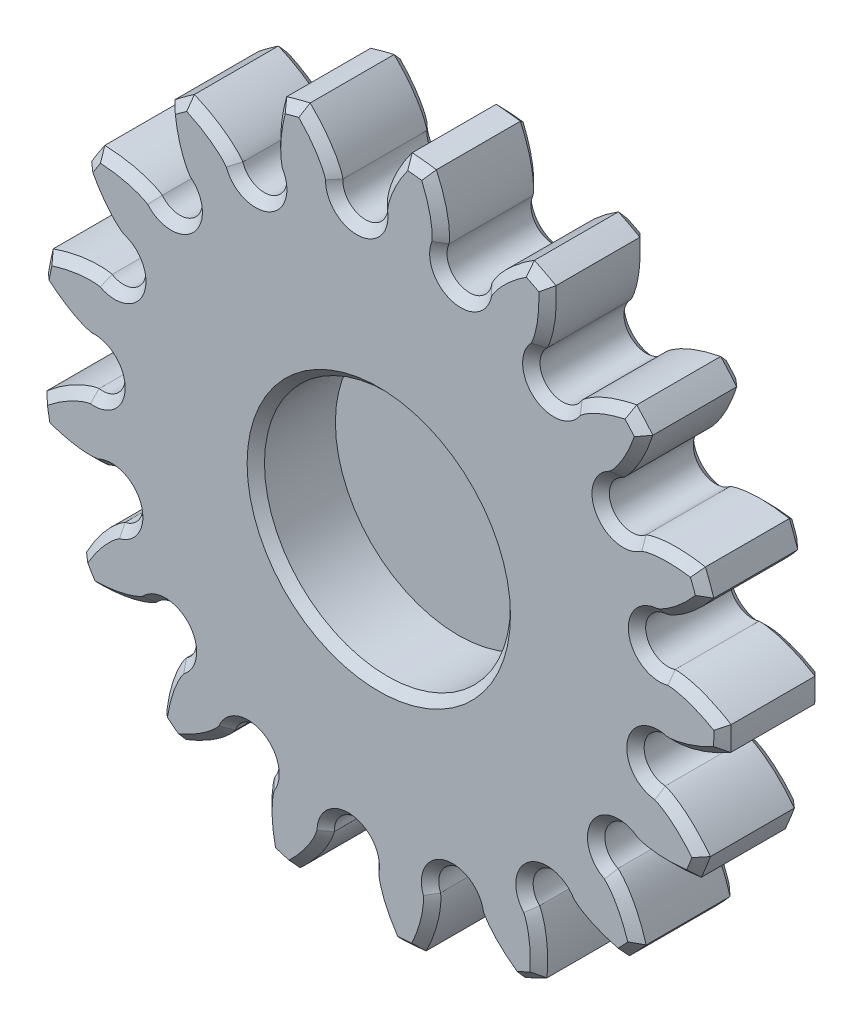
SolidWorks part; units mm, degrees
ref_plane "Plan de face" through (0, 0, 0) normal (0, 0, 1) x (1, 0, 0)
ref_plane "Plan de dessus" through (0, 0, 0) normal (0, 1, 0) x (1, 0, 0)
ref_plane "Plan de droite" through (0, 0, 0) normal (1, 0, 0) x (0, 0, -1)
sketch "Esquisse6" plane through (0, 0, 0) normal (0, 0, 1) x (1, 0, 0)
  line L0 (0.3196, 21.2476) -> (0, 0) construction
  line L1 (0, 0) -> (-1.4007, 18.0708) construction
  line L2 (0, 0) -> (5.2218, 17.3565) construction
  line L3 (2.5468, 23.613) -> (0, 0) construction
  line L4 (-0.1459, -1.3527) -> (5.4607, 17.2828)
  line L5 (-0.1459, -1.3527) -> (-1.6498, 18.0498)
  line L6 (-1.4007, 18.0708) -> (-1.6498, 18.0498)
  line L7 (-1.6498, 18.0498) -> (5.2218, 17.3565) construction
  line L8 (5.2218, 17.3565) -> (5.4607, 17.2828)
  line L10 (-0.1459, -1.3527) -> (-1.6711, 18.3248) construction
  line L11 (-0.1459, -1.3527) -> (5.5402, 17.547) construction
  circle A0 centre (0, 0) radius 21.25 construction
  circle A1 centre (0, 0) radius 18.125 construction
  arc A2 (3.3803, 23.5082) -> (1.7102, 23.6883) centre (0, 0) ccw
  arc A3 (-1.4007, 18.0708) -> (0, 19.9609) centre (-1.5211, 19.6241) ccw
  arc A4 (5.2218, 17.3565) -> (4.2564, 19.5018) centre (5.6707, 18.8484) cw
  arc A5 (-1.6711, 18.3248) -> (-0.2506, 19.9348) centre (-1.5211, 19.6241) ccw construction
  arc A6 (3.551, 23.7358) -> (1.592, 23.9471) centre (0, 0) ccw construction
  arc A7 (5.5402, 17.547) -> (4.4956, 19.4229) centre (5.6707, 18.8484) cw construction
  spline S0 degree 4 poles (0, 19.9609) (0.0003, 19.9757) (0.0022, 20.017) (0.0095, 20.095) (0.0268, 20.2218) (0.0567, 20.3824) (0.1044, 20.5884) (0.1722, 20.8287) (0.2586, 21.09) (0.3653, 21.3706) (0.483, 21.6471) (0.6105, 21.9192) (0.7469, 22.1869) (0.9224, 22.5066) (1.1483, 22.8838) (1.432, 23.3138) (1.7801, 23.79) (2.1572, 24.2587) (2.553, 24.7099) (2.9687, 25.1459) (3.3977, 25.5636) (3.8471, 25.9686) (4.2439, 26.3034) (4.6058, 26.5894) (4.8908, 26.8073) (5.1584, 27.0013) (5.4159, 27.1872) (5.8578, 27.4838) (6.1363, 27.6635) (6.5758, 27.9339) (6.7396, 28.0269) (6.8696, 28.1032) knots 0 0 0 0 0 0.005377 0.015084 0.028532 0.04661 0.064855 0.092111 0.119476 0.146842 0.174209 0.201575 0.228941 0.256307 0.307035 0.361767 0.4165 0.471232 0.525964 0.580697 0.635429 0.690161 0.744894 0.77226 0.799626 0.826992 0.854358 0.909091 0.954545 1 1 1 1 1 construction
  spline S1 degree 4 poles (0, 19.9609) (0.0003, 19.9757) (0.0022, 20.017) (0.0095, 20.095) (0.0268, 20.2218) (0.0567, 20.3824) (0.1044, 20.5884) (0.1722, 20.8287) (0.2586, 21.09) (0.3653, 21.3706) (0.483, 21.6471) (0.6105, 21.9192) (0.7469, 22.1869) (0.9224, 22.5066) (1.1483, 22.8838) (1.3736, 23.2253) (1.5674, 23.497) (1.6836, 23.653) (1.7102, 23.6883) knots 0 0 0 0 0 0.005377 0.015084 0.028532 0.04661 0.064855 0.092111 0.119476 0.146842 0.174209 0.201575 0.228941 0.256307 0.307035 0.361767 0.377899 0.377899 0.377899 0.377899 0.377899
  spline S2 degree 4 poles (4.2564, 19.5018) (4.2592, 19.5163) (4.2662, 19.5571) (4.2757, 19.6349) (4.2858, 19.7624) (4.2908, 19.9257) (4.2881, 20.1371) (4.2732, 20.3864) (4.2445, 20.6601) (4.2001, 20.957) (4.144, 21.2522) (4.0775, 21.5453) (4.0013, 21.8359) (3.898, 22.1856) (3.7578, 22.6024) (3.6104, 22.9841) (3.479, 23.2908) (3.3988, 23.468) (3.3803, 23.5082) knots 0 0 0 0 0 0.005377 0.015084 0.028532 0.04661 0.064855 0.092111 0.119476 0.146842 0.174209 0.201575 0.228941 0.256307 0.307035 0.361767 0.377899 0.377899 0.377899 0.377899 0.377899
  spline S3 degree 1 poles (-0.2506, 19.9348) (1.592, 23.9471) knots 0 0 1 1 construction
  spline S4 degree 1 poles (4.4956, 19.4229) (3.551, 23.7358) knots 0 0 1 1 construction
  spline S5 degree 3 poles (-0.2506, 19.9348) (-0.2464, 20.1313) (-0.1759, 20.5289) (0.0317, 21.2409) (0.5449, 22.4428) (1.1512, 23.3609) (1.592, 23.9471) knots -0.002856 -0.002856 -0.002856 -0.002856 0.046285 0.095426 0.193707 0.39027 0.39027 0.39027 0.39027 construction
  spline S6 degree 3 poles (3.551, 23.7358) (3.8566, 23.0691) (4.2532, 22.0428) (4.4983, 20.7591) (4.5494, 20.0193) (4.5335, 19.6158) (4.4956, 19.4229) knots -0.002856 -0.002856 -0.002856 -0.002856 0.193707 0.291989 0.341129 0.39027 0.39027 0.39027 0.39027 construction
  point P14 (-1.4007, 18.0708)
  dimension "D1" = 42.5
  dimension "D2" = 2.5
  dimension "D3" = 3.125
  dimension "D4" = 5.294
  dimension "D5" = 0.25
extrude "Boss.-Extru.3" add sketch "Esquisse6" along normal blind 7
pattern_circular "Répétition circulaire1" count 17 every 21.176 of "Boss.-Extru.3"
sketch "Esquisse2" plane through (0, 0, 10) normal (0, 0, 1) x (1, 0, 0)
  circle A0 centre (0, 0) radius 0.5
  dimension "D1" = 1
sketch "Esquisse3" plane through (0, 0, 10) normal (0, 0, 1) x (1, 0, 0)
  line L0 (1.3829, 74.9872) -> (0, 0) construction
  line L1 (0, 0) -> (4.032, 90.3021) construction
  line L2 (0, 0) -> (-0.6996, 90.3894) construction
  line L3 (-0.5502, 71.0841) -> (0, 0)
  line L4 (0, 0) -> (6.8831, 70.7522)
  circle A0 centre (0, 0) radius 75 construction
  arc A1 (6.8831, 70.7522) -> (6.0695, 71.6183) centre (6.9704, 71.6495) cw
  arc A2 (4.3716, 77.3766) -> (2.5417, 77.4583) centre (0, 0) ccw
  arc A3 (-0.5502, 71.0841) -> (0.3374, 71.8742) centre (-0.5572, 71.9856) ccw
  spline S0 degree 4 poles (0, 69.8212) (0.0011, 69.8728) (0.0075, 70.0175) (0.0331, 70.2904) (0.0936, 70.7338) (0.1984, 71.2954) (0.3654, 72.016) (0.6022, 72.8567) (0.9045, 73.7706) (1.2778, 74.7522) (1.6895, 75.7194) (2.1355, 76.6712) (2.6126, 77.6077) (3.2265, 78.7257) (4.0167, 80.0455) (5.0088, 81.5493) (6.227, 83.2152) (7.5451, 84.8538) (8.9313, 86.4335) (10.201, 87.7664) (11.3227, 88.8715) (12.284, 89.7714) (13.059, 90.4728) (14.0589, 91.3421) (15.0518, 92.1709) (16.1072, 93.0048) (17.323, 93.932) (18.4586, 94.7496) (19.4157, 95.4198) (20.645, 96.2319) (21.2771, 96.6388) (22.1762, 97.2025) (22.8496, 97.6093) (23.4644, 97.9754) (23.8116, 98.175) (24.0137, 98.2922) knots 0 0 0 0 0 0.005377 0.015084 0.028532 0.04661 0.064855 0.092111 0.119476 0.146842 0.174209 0.201575 0.228941 0.256307 0.307035 0.361767 0.4165 0.471232 0.525964 0.580697 0.608063 0.635429 0.662795 0.690161 0.744894 0.77226 0.799626 0.854358 0.881725 0.909091 0.931818 0.954545 0.977273 1 1 1 1 1 construction
  spline S1 degree 4 poles (0.3374, 71.8742) (0.362, 71.9728) (0.4527, 72.3246) (0.6253, 72.9266) (0.9045, 73.7706) (1.2778, 74.7522) (1.6895, 75.7194) (2.0622, 76.5148) (2.3377, 77.0653) (2.5, 77.3785) (2.5417, 77.4583) knots 0.054269 0.054269 0.054269 0.054269 0.054269 0.064855 0.092111 0.119476 0.146842 0.174209 0.201575 0.210956 0.210956 0.210956 0.210956 0.210956
  spline S2 degree 4 poles (6.0695, 71.6183) (6.0538, 71.7187) (5.9948, 72.0772) (5.8765, 72.6921) (5.6736, 73.5577) (5.3894, 74.5686) (5.0655, 75.5686) (4.7651, 76.3941) (4.5398, 76.967) (4.406, 77.2934) (4.3716, 77.3766) knots 0.054269 0.054269 0.054269 0.054269 0.054269 0.064855 0.092111 0.119476 0.146842 0.174209 0.201575 0.210956 0.210956 0.210956 0.210956 0.210956
  dimension "D1" = 150
  dimension "D2" = 2.5
  dimension "D4" = 1.5
sketch "Esquisse4" plane through (0, 0, 0) normal (0, 0, -1) x (-1, 0, 0)
  circle A0 centre (0, 0) radius 1.8
  dimension "D1" = 3.6
sketch "Esquisse7" plane through (0, 0, 7) normal (0, 0, 1) x (1, 0, 0)
  circle A0 centre (0, 0) radius 8.5
  dimension "D1" = 17
extrude "Enlèv. mat.-Extru.3" cut sketch "Esquisse7" against normal blind 5.5
sketch "Esquisse5" plane through (0, 0, 0) normal (0, 0, -1) x (-1, 0, 0)
  line L1 (2.0494, -1.6) -> (-2.0494, -1.6)
  line L3 (2.0494, 1.6) -> (-2.0494, 1.6)
  line L5 (5.3589, -1.6) -> (-5.3589, 1.6) construction
  line L6 (5.3589, 1.6) -> (-5.3589, -1.6) construction
  circle A0 centre (0, 0) radius 5.8
  arc A1 (-2.0494, 1.6) -> (-2.0494, -1.6) centre (0, 0) ccw
  arc A2 (2.0494, -1.6) -> (2.0494, 1.6) centre (0, 0) ccw
  dimension "D2" = 5.2
  dimension "D3" = 11.6
  dimension "D1" = 3.2
extrude "Boss.-Extru.2" add sketch "Esquisse5" along normal blind 6
sketch "Esquisse8" plane through (0, 0, 0) normal (0, 0, -1) x (-1, 0, 0)
  circle A0 centre (0, 0) radius 7.8
  circle A1 centre (0, 0) radius 12.5
  circle A2 centre (0, 0) radius 5.8 construction
  dimension "D1" = 25
  dimension "D2" = 2
extrude "Enlèv. mat.-Extru.4" cut sketch "Esquisse8" against normal blind 1
chamfer "Chanfrein1" distance 0.6 angle 45 143 edges at (-2.6, 0, -6) (0, 1.6, -6) (2.6, 0, -6) (0, -1.6, -6) (-5.8, 0, -6) (2.5468, 23.613, 0) (-1.4007, 18.0708, 0) (-6.1552, 22.9385, 0) (-6.1552, 22.9385, 7) (-7.834, 16.3445, 0) (-7.834, 16.3445, 7) (-14.0259, 19.1661, 0) (-14.0259, 19.1661, 7) (-13.2093, 12.4108, 0) (-13.2093, 12.4108, 7) (-20.0023, 12.8051, 0) (-20.0023, 12.8051, 7) (-16.8007, 6.801, 0) (-16.8007, 6.801, 7) (-23.2773, 4.7147, 0) (-23.2773, 4.7147, 7) (-18.1229, 0.2726, 0) (-18.1229, 0.2726, 7) (-23.4086, -4.0124, 0) (-23.4086, -4.0124, 7) (-16.9976, -6.2925, 0) (-16.9976, -6.2925, 7) (-20.3784, -12.1976, 0) (-20.3784, -12.1976, 7) (-13.5767, -12.0079, 0) (-13.5767, -12.0079, 7) (-14.596, -18.7355, 0) (-14.596, -18.7355, 7) (-8.3221, -16.1015, 0) (-8.3221, -16.1015, 7) (-6.8424, -22.743, 0) (-6.8424, -22.743, 7) (-1.9436, -18.0205, 0) (-1.9436, -18.0205, 7) (1.8354, -23.679, 0) (1.8354, -23.679, 7) (4.6974, -17.5057, 0) (4.6974, -17.5057, 7) (10.2653, -21.417, 0) (10.2653, -21.417, 7) (10.7039, -14.6267, 0) (10.7039, -14.6267, 7) (17.3088, -16.2625, 0) (17.3088, -16.2625, 7) (15.2649, -9.7723, 0) (15.2649, -9.7723, 7) (22.0147, -8.9116, 0) (22.0147, -8.9116, 7) (17.7643, -3.5981, 0) (17.7643, -3.5981, 7) (23.7473, -0.3572, 0) (23.7473, -0.3572, 7) (17.8645, 3.0621, 0) (17.8645, 3.0621, 7) (22.2728, 8.2454, 0) (22.2728, 8.2454, 7) (15.552, 9.3087, 0) (15.552, 9.3087, 7) (17.7902, 15.7345, 0) (17.7902, 15.7345, 7) (11.1391, 14.2981, 0) (11.1391, 14.2981, 7) (10.9049, 21.0985, 0) (10.9049, 21.0985, 7) (5.2218, 17.3565, 0) (-1.4007, 18.0708, 7) (2.5468, 23.613, 7) (5.2218, 17.3565, 7) (8.5, 0, 7) (-12.5, 0, 0)
